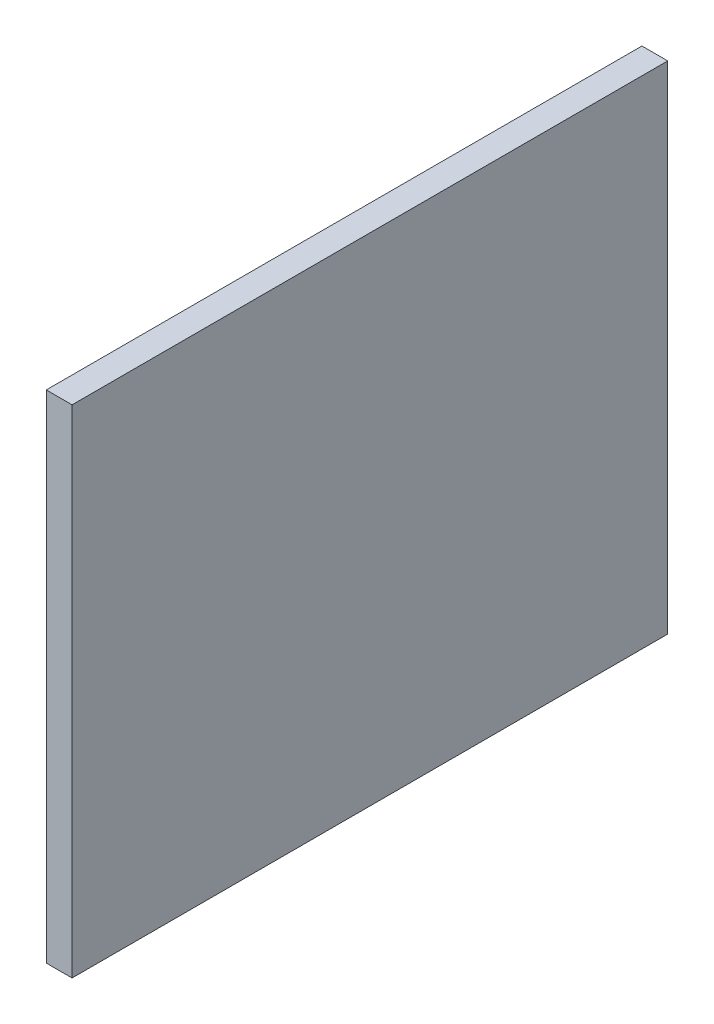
SolidWorks part; units mm, degrees
ref_plane "Front Plane" through (0, 0, 0) normal (0, 0, 1) x (1, 0, 0)
ref_plane "Top Plane" through (0, 0, 0) normal (0, 1, 0) x (1, 0, 0)
ref_plane "Right Plane" through (0, 0, 0) normal (1, 0, 0) x (0, 0, -1)
ref_plane "Front Plane-Chute_Master" through (0, 0, 0) normal (0, 0, 1) x (1, 0, 0)
ref_plane "Top Plane-Chute_Master" through (0, 0, 0) normal (0, 1, 0) x (1, 0, 0)
ref_plane "Right Plane-Chute_Master" through (0, 0, 0) normal (1, 0, 0) x (0, 0, -1)
sketch "Sketch1-Chute_Master" plane through (0, 0, 0) normal (0, 0, 1) x (1, 0, 0)
  line L1 (50.8, -31.75) -> (-50.8, -31.75) construction
  line L2 (50.8, -31.75) -> (50.8, 31.75) construction
  line L3 (50.8, 31.75) -> (-50.8, 31.75) construction
  line L4 (-50.8, -31.75) -> (-50.8, 31.75) construction
  line L5 (50.8, -31.75) -> (-50.8, 31.75) construction
  line L6 (50.8, 31.75) -> (-50.8, -31.75) construction
  point P0 (0, 0)
  dimension "D1" = 63.5
  dimension "D2" = 101.6
sketch "Sketch2-Chute_Master" plane through (0, 0, 0) normal (0, 1, 0) x (1, 0, 0)
  line L1 (-38.1, 0) -> (38.1, 0) construction
  line L2 (-38.1, 0) -> (-38.1, -76.2) construction
  line L3 (-38.1, -76.2) -> (38.1, -76.2) construction
  line L4 (38.1, 0) -> (38.1, -76.2) construction
  dimension "D1" = 76.2
  dimension "D2" = 76.2
sketch "Sketch3-Chute_Master" plane through (0, 0, 0) normal (1, 0, 0) x (0, 0, -1)
  line L1 (0, 0) -> (-76.2, 0) construction
  line L2 (0, 0) -> (0, 45.72) construction
  line L3 (0, 45.72) -> (-76.2, 45.72) construction
  line L4 (-76.2, 0) -> (-76.2, 45.72) construction
  dimension "D1" = 45.72
inserted part "Chute_Master"
sketch "Sketch4" plane through (0, 0, 0) normal (1, 0, 0) x (0, 0, -1)
  line L0 (0, 27.94) -> (0, -27.94) construction
  line L1 (0, 31.75) -> (-76.2, 31.75)
  line L2 (0, 31.75) -> (0, -31.75)
  line L3 (0, -31.75) -> (-76.2, -31.75)
  line L4 (-76.2, 31.75) -> (-76.2, -31.75)
  line L5 (-76.2, 0) -> (-76.2, 45.72) construction
extrude "Boss-Extrude1" add sketch "Sketch4" along normal blind 3.302
equation "\"thick\"= 0.125"
